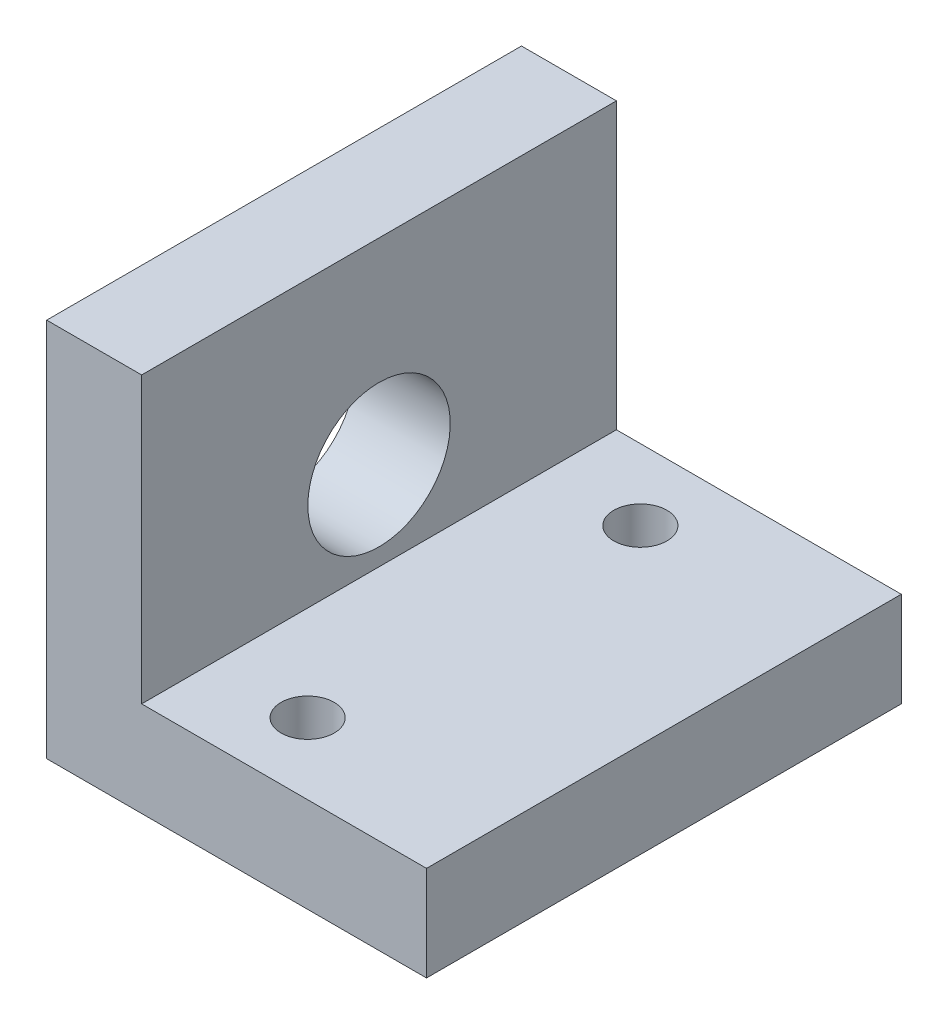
SolidWorks part; units mm, degrees
ref_plane "Front Plane" through (0, 0, 0) normal (0, 0, 1) x (1, 0, 0)
ref_plane "Top Plane" through (0, 0, 0) normal (0, 1, 0) x (1, 0, 0)
ref_plane "Right Plane" through (0, 0, 0) normal (1, 0, 0) x (0, 0, -1)
sketch "Sketch1" plane through (0, 0, 0) normal (0, 0, 1) x (1, 0, 0)
  line L0 (0, 0) -> (0, 25.4)
  line L1 (0, 25.4) -> (6.35, 25.4)
  line L2 (6.35, 25.4) -> (6.35, 6.35)
  line L3 (6.35, 6.35) -> (25.4, 6.35)
  line L4 (25.4, 6.35) -> (25.4, 0)
  line L5 (25.4, 0) -> (0, 0)
  dimension "D1" = 6.35
  dimension "D2" = 6.35
  dimension "D3" = 25.4
  dimension "D4" = 25.4
extrude "Boss-Extrude1" add sketch "Sketch1" against normal blind 31.75
sketch "Sketch2" plane through (0, 0, 0) normal (-1, 0, 0) x (0, 0, 1)
  line L0 (-31.75, 0) -> (0, 0) construction
  circle A0 centre (-15.875, 12.2682) radius 4.7625
  dimension "D1" = 9.525
  dimension "D2" = 12.2682
extrude "Cut-Extrude1" cut sketch "Sketch2" against normal through all
sketch "Sketch3" plane through (0, 6.35, 0) normal (0, 1, 0) x (1, 0, 0)
  line L0 (25.4, 31.75) -> (6.35, 31.75) construction
  line L1 (25.4, 0) -> (6.35, 0) construction
  line L2 (25.4, 31.75) -> (25.4, 0) construction
  circle A0 centre (12.7, 27.0002) radius 1.778
  circle A1 centre (12.7, 4.7498) radius 1.778
  dimension "D1" = 3.556
  dimension "D2" = 3.556
  dimension "D4" = 4.7498
  dimension "D3" = 4.7498
  dimension "D5" = 12.7
  dimension "D6" = 12.7
extrude "Cut-Extrude2" cut sketch "Sketch3" against normal through all
